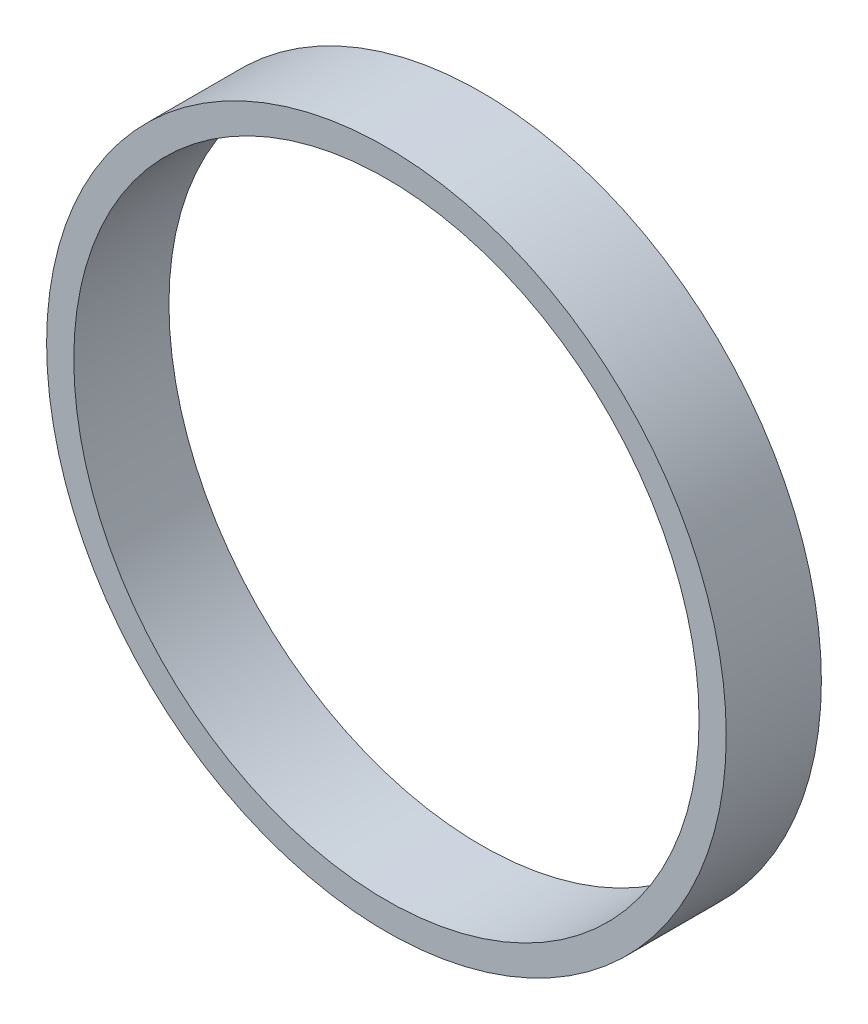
SolidWorks part; units mm, degrees
ref_plane "Front Plane" through (0, 0, 0) normal (0, 0, 1) x (1, 0, 0)
ref_plane "Top Plane" through (0, 0, 0) normal (0, 1, 0) x (1, 0, 0)
ref_plane "Right Plane" through (0, 0, 0) normal (1, 0, 0) x (0, 0, -1)
sketch "Sketch1" plane through (0, 0, 0) normal (0, 0, 1) x (1, 0, 0)
  circle A0 centre (0, 0) radius 25
  circle A1 centre (0, 0) radius 23
  dimension "D1" = 46
  dimension "D2" = 2
extrude "Boss-Extrude1" add sketch "Sketch1" along normal blind 7
